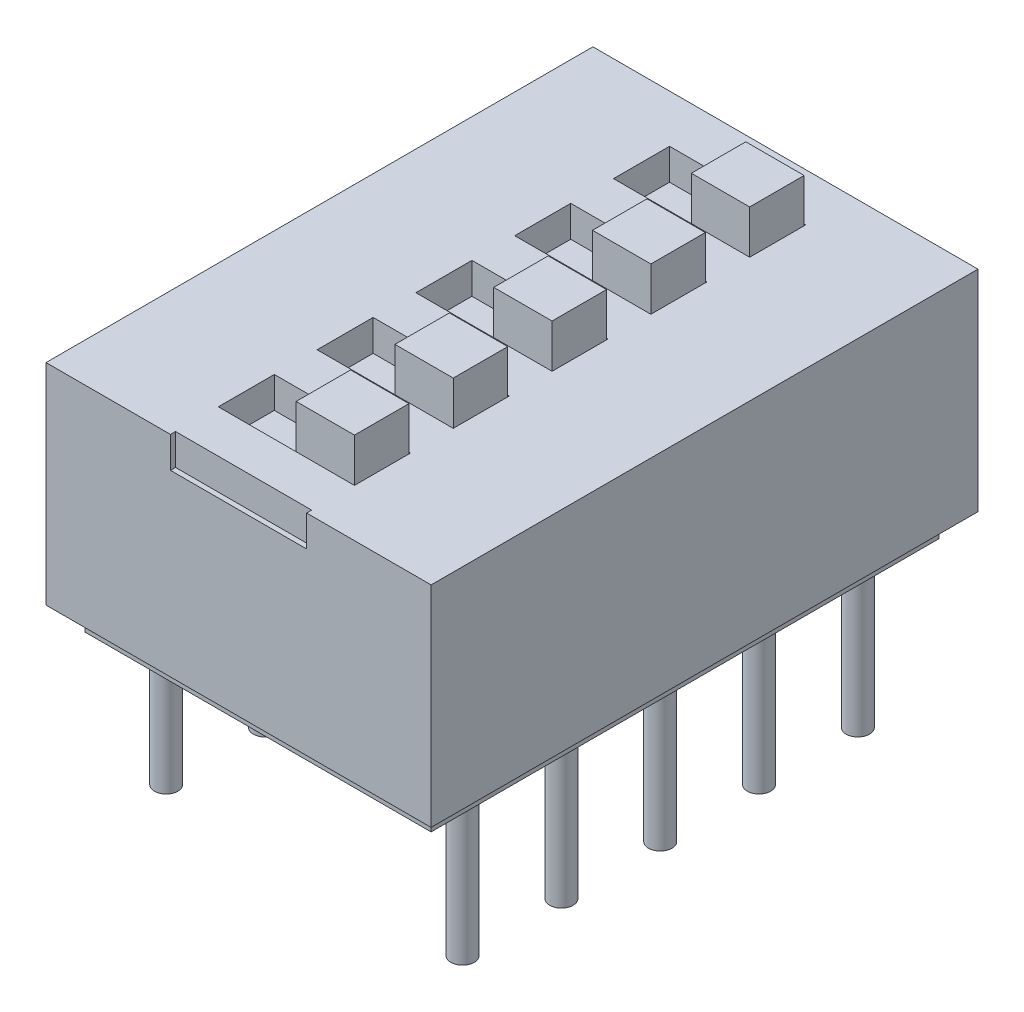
SolidWorks part; units mm, degrees
ref_plane "Plan de face" through (0, 0, 0) normal (0, 0, 1) x (1, 0, 0)
ref_plane "Plan de dessus" through (0, 0, 0) normal (0, 1, 0) x (1, 0, 0)
ref_plane "Plan de droite" through (0, 0, 0) normal (1, 0, 0) x (0, 0, -1)
sketch "Esquisse1" plane through (0, 0, 0) normal (0, 0, 1) x (1, 0, 0)
  line L0 (-9.541, 0) -> (21.5285, 0) construction
  line L1 (0, -1.2116) -> (0, 23.1187) construction
  line L2 (-4.95, -3.792) -> (-4.95, 12.2258) construction
  line L3 (-9.541, 5.4) -> (21.5285, 5.4) construction
  line L4 (4.95, -3.792) -> (4.95, 12.2258) construction
  line L6 (-4.95, 5.4) -> (4.95, 5.4)
  line L7 (-4.95, 5.4) -> (-4.95, 0)
  line L8 (-4.95, 0) -> (4.95, 0)
  line L9 (4.95, 5.4) -> (4.95, 0)
  dimension "D1" = 4.95
  dimension "D2" = 9.9
  dimension "D3" = 5.4
extrude "Boss.-Extru.1" add sketch "Esquisse1" along normal blind 14.06
sketch "Esquisse2" plane through (0, 5.4, 0) normal (0, 1, 0) x (1, 0, 0)
  line L0 (-7.5233, 0) -> (6.4204, 0) construction
  line L1 (-3.381, -1.95) -> (6.4204, -1.95) construction
  line L2 (0, 0.9083) -> (0, -14.5675) construction
  line L3 (-7.5233, -1.23) -> (3.0824, -1.23) construction
  line L4 (-1.75, 2.1221) -> (-1.75, -3.3399) construction
  line L5 (1.75, 2.1221) -> (1.75, -3.3399) construction
  line L6 (-7.5233, -2.67) -> (3.0824, -2.67) construction
  line L7 (-1.75, -3.77) -> (1.75, -3.77)
  line L8 (-1.75, -1.23) -> (1.75, -1.23)
  line L9 (-1.75, -1.23) -> (-1.75, -2.67)
  line L10 (-1.75, -2.67) -> (1.75, -2.67)
  line L11 (1.75, -1.23) -> (1.75, -2.67)
  line L12 (-1.75, -3.77) -> (-1.75, -5.21)
  line L13 (-1.75, -5.21) -> (1.75, -5.21)
  line L14 (1.75, -3.77) -> (1.75, -5.21)
  line L15 (-1.75, -6.31) -> (1.75, -6.31)
  line L16 (-1.75, -6.31) -> (-1.75, -7.75)
  line L17 (-1.75, -7.75) -> (1.75, -7.75)
  line L18 (1.75, -6.31) -> (1.75, -7.75)
  line L19 (-1.75, -8.85) -> (1.75, -8.85)
  line L20 (-1.75, -8.85) -> (-1.75, -10.29)
  line L21 (-1.75, -10.29) -> (1.75, -10.29)
  line L22 (1.75, -8.85) -> (1.75, -10.29)
  line L23 (-1.75, -11.39) -> (1.75, -11.39)
  line L24 (-1.75, -11.39) -> (-1.75, -12.83)
  line L25 (-1.75, -12.83) -> (1.75, -12.83)
  line L26 (1.75, -11.39) -> (1.75, -12.83)
  line L27 (-1.75, -13.93) -> (1.75, -13.93)
  line L28 (-1.75, -13.93) -> (-1.75, -14.1533)
  line L30 (1.75, -13.93) -> (1.75, -14.1533)
  line L31 (-1.75, -14.1533) -> (1.75, -14.1533)
  line L32 (-1.75, -15.37) -> (1.75, -15.37)
  dimension "D1" = 1.95
  dimension "D2" = 1.44
  dimension "D3" = 3.5
  dimension "D4" = 1.75
  dimension "D5" = 0.72
  dimension "D6" = 5
  dimension "D7" = 2
extrude "Enlèv. mat.-Extru.1" cut sketch "Esquisse2" against normal blind 0.8
sketch "Esquisse3" plane through (0, 4.6, 0) normal (0, 1, 0) x (1, 0, 0)
  line L0 (2.2148, -1.95) -> (-0.4475, -1.95) construction
  line L1 (2.2148, -1.25) -> (-0.4012, -1.25) construction
  line L2 (2.2148, -2.65) -> (-0.3664, -2.65) construction
  line L3 (1.73, -1.0106) -> (1.73, -2.8221) construction
  line L4 (0.23, -1.0106) -> (0.23, -2.8221) construction
  line L5 (1.75, -2.67) -> (1.75, -1.23) construction
  line L6 (0.23, -3.79) -> (0.23, -5.19)
  line L7 (0.23, -1.25) -> (1.73, -1.25)
  line L8 (0.23, -1.25) -> (0.23, -2.65)
  line L9 (0.23, -2.65) -> (1.73, -2.65)
  line L10 (1.73, -1.25) -> (1.73, -2.65)
  line L11 (0.23, -3.79) -> (1.73, -3.79)
  line L12 (1.73, -3.79) -> (1.73, -5.19)
  line L13 (0.23, -5.19) -> (1.73, -5.19)
  line L14 (0.23, -6.33) -> (0.23, -7.73)
  line L15 (0.23, -6.33) -> (1.73, -6.33)
  line L16 (1.73, -6.33) -> (1.73, -7.73)
  line L17 (0.23, -7.73) -> (1.73, -7.73)
  line L18 (0.23, -8.87) -> (0.23, -10.27)
  line L19 (0.23, -8.87) -> (1.73, -8.87)
  line L20 (1.73, -8.87) -> (1.73, -10.27)
  line L21 (0.23, -10.27) -> (1.73, -10.27)
  line L22 (0.23, -11.41) -> (0.23, -12.81)
  line L23 (0.23, -11.41) -> (1.73, -11.41)
  line L24 (1.73, -11.41) -> (1.73, -12.81)
  line L25 (0.23, -12.81) -> (1.73, -12.81)
  dimension "D1" = 0.7
  dimension "D2" = 0.7
  dimension "D3" = 1.5
  dimension "D4" = 0.02
  dimension "D5" = 5
extrude "Boss.-Extru.2" add sketch "Esquisse3" along normal blind 1.9
sketch "Esquisse4" plane through (0, 0, 0) normal (0, -1, 0) x (1, 0, 0)
  line L0 (-5.7, 14.06) -> (8.3376, 14.06) construction
  line L1 (4.95, 14.7569) -> (4.95, -0.4491) construction
  line L2 (4.45, -0.4491) -> (4.45, 14.7569) construction
  line L3 (8.3376, 13.56) -> (-5.7, 13.56) construction
  line L4 (-4.45, 14.7569) -> (-4.45, -0.4491) construction
  line L5 (-5.7, 0.5) -> (8.3376, 0.5) construction
  line L6 (-4.95, 0) -> (4.95, 0) construction
  line L7 (-4.95, 14.06) -> (-4.95, 0) construction
  line L9 (-4.45, 13.56) -> (4.45, 13.56)
  line L10 (-4.45, 13.56) -> (-4.45, 0.5)
  line L11 (-4.45, 0.5) -> (4.45, 0.5)
  line L12 (4.45, 13.56) -> (4.45, 0.5)
  dimension "D1" = 0.5
  dimension "D2" = 0.5
  dimension "D3" = 0.5
  dimension "D4" = 0.5
extrude "Boss.-Extru.3" add sketch "Esquisse4" along normal blind 0.6
sketch "Esquisse5" plane through (0, -0.6, 0) normal (0, -1, 0) x (1, 0, 0)
  line L0 (0, -0.6261) -> (0, 14.5445) construction
  line L1 (5.9302, 0) -> (-2.9739, 0) construction
  line L2 (-4.95, 0) -> (4.95, 0) construction
  line L3 (5.9302, 1.95) -> (2.0534, 1.95) construction
  line L4 (3.81, -0.6261) -> (3.81, 14.5445) construction
  circle A0 centre (3.81, 1.95) radius 0.3
  circle A1 centre (3.81, 4.49) radius 0.3
  circle A2 centre (3.81, 7.03) radius 0.3
  circle A3 centre (3.81, 9.57) radius 0.3
  circle A4 centre (3.81, 12.11) radius 0.3
  circle A5 centre (-3.81, 1.95) radius 0.3
  circle A6 centre (-3.81, 4.49) radius 0.3
  circle A7 centre (-3.81, 7.03) radius 0.3
  circle A8 centre (-3.81, 9.57) radius 0.3
  circle A9 centre (-3.81, 12.11) radius 0.3
  dimension "D3" = 5
  dimension "D1" = 1.95
  dimension "D2" = 3.81
  dimension "D4" = 2
extrude "Boss.-Extru.4" add sketch "Esquisse5" along normal blind 3.8
